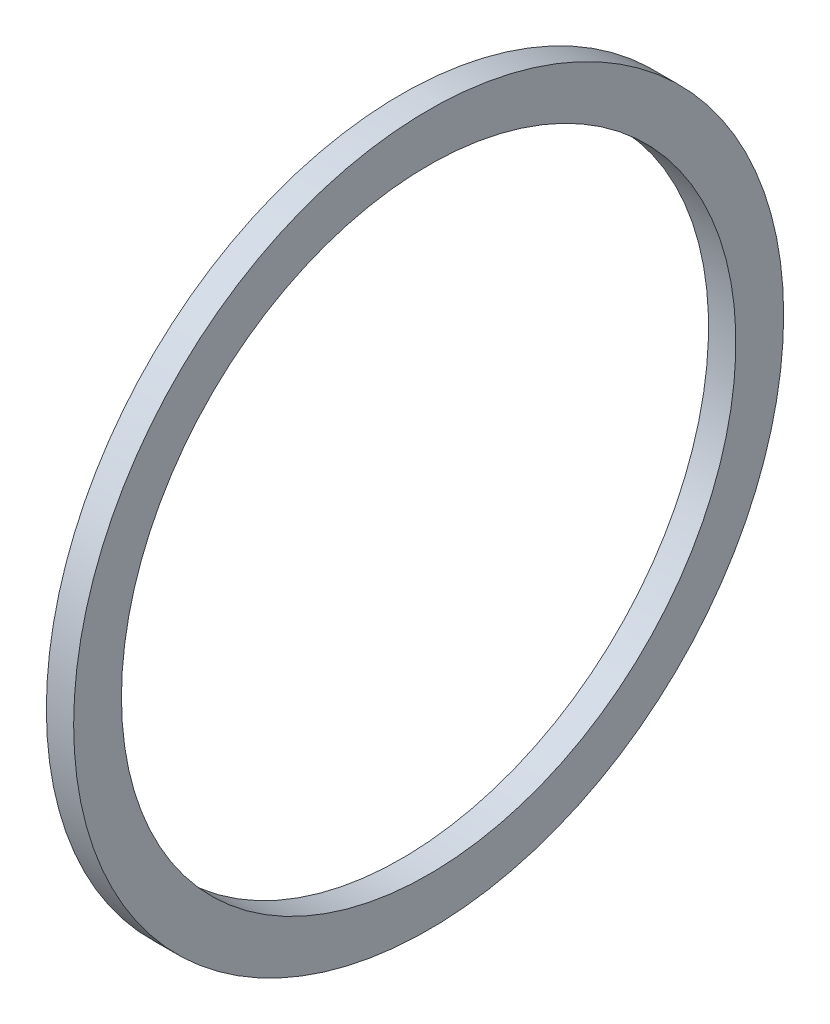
SolidWorks part; units mm, degrees
ref_plane "Plan de face" through (0, 0, 0) normal (0, 0, 1) x (1, 0, 0)
ref_plane "Plan de dessus" through (0, 0, 0) normal (0, 1, 0) x (1, 0, 0)
ref_plane "Plan de droite" through (0, 0, 0) normal (1, 0, 0) x (0, 0, -1)
sketch "Esquisse1" plane through (0, 0, 0) normal (0, 0, 1) x (1, 0, 0)
  line L0 (18, 26) -> (18, -26) construction
  line L1 (16, 26) -> (18, 26)
  line L2 (16, 26) -> (16, 22.5)
  line L3 (16, 22.5) -> (18, 22.5)
  line L4 (18, 26) -> (18, 22.5)
  line L5 (16, -26) -> (16, 26) construction
  line L6 (17, 22.5) -> (16, 22.5) construction
  line L7 (18, 26) -> (15, 26) construction
  line L8 (0, 0) -> (35.1663, 0) construction
revolve "Révolution1" add sketch "Esquisse1" angle 360 about L8
